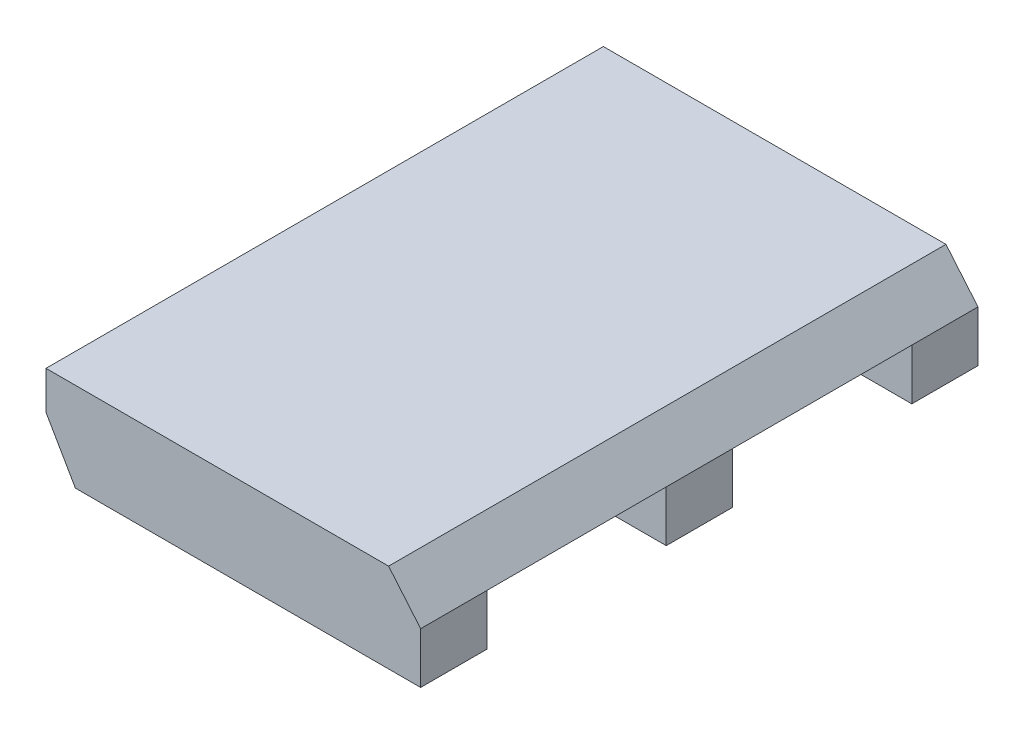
SolidWorks part; units mm, degrees
ref_plane "Plan de face" through (0, 0, 0) normal (0, 0, 1) x (1, 0, 0)
ref_plane "Plan de dessus" through (0, 0, 0) normal (0, 1, 0) x (1, 0, 0)
ref_plane "Plan de droite" through (0, 0, 0) normal (1, 0, 0) x (0, 0, -1)
sketch "Esquisse1" plane through (0, 0, 0) normal (0, 0, 1) x (1, 0, 0)
  line L0 (13.4614, 0) -> (14.72, -1.5)
  line L1 (0, 0) -> (13.4614, 0)
  line L2 (0, 0) -> (0, -1.5)
  line L3 (0, -1.5) -> (14.72, -1.5)
  dimension "D1" = 14.72
  dimension "D2" = 50
  dimension "D3" = 1.5
extrude "Boss.-Extru.1" add sketch "Esquisse1" along normal blind 21.9
sketch "Esquisse2" plane through (0, 0, 21.9) normal (0, 0, 1) x (1, 0, 0)
  line L0 (0, -1.5) -> (14.72, -1.5) construction
  line L1 (0, -1.5) -> (14.72, -1.5)
  line L3 (1.1547, -3.5) -> (14.72, -3.5)
  line L4 (14.72, -1.5) -> (14.72, -3.5)
  line L5 (0, -1.5) -> (1.1547, -3.5)
  dimension "D1" = 60
  dimension "D2" = 2
extrude "Boss.-Extru.2" add sketch "Esquisse2" against normal blind 2.6
pattern_linear "Répétition linéaire1" count 3 spacing 9.65 along (0, 0, -1) of "Boss.-Extru.2"
